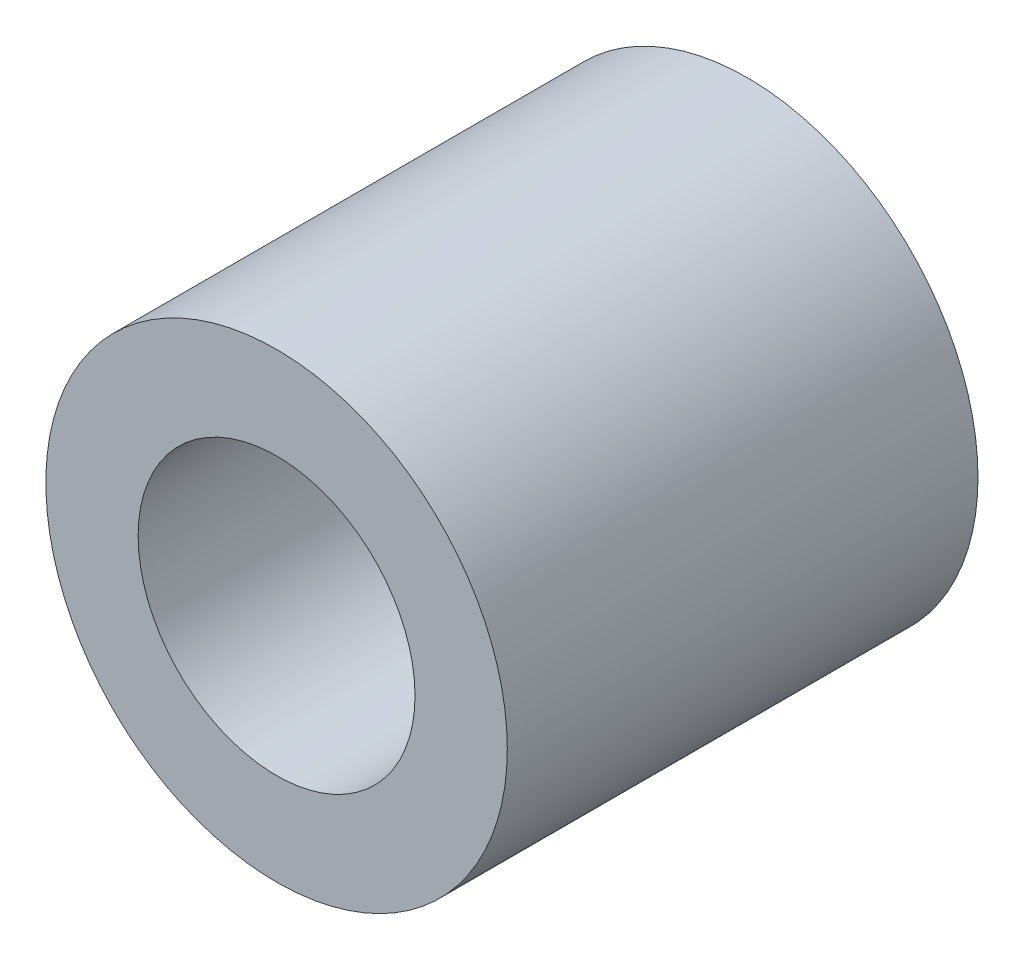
SolidWorks part; units mm, degrees
ref_plane "Front" through (0, 0, 0) normal (0, 0, 1) x (1, 0, 0)
ref_plane "Top" through (0, 0, 0) normal (0, 1, 0) x (1, 0, 0)
ref_plane "Right" through (0, 0, 0) normal (1, 0, 0) x (0, 0, -1)
sketch "Sketch1" plane through (0, 0, 0) normal (0, 0, 1) x (1, 0, 0)
  line L1 (0, 0) -> (4.8093, 0) construction
  line L3 (-4.9024, -1.5) -> (5.4609, -1.5) construction
  circle A0 centre (0, 0) radius 2.5
  circle A1 centre (0, 0) radius 1.5
  dimension "D3" = 3
  dimension "D1" = 5
extrude "Base-Extrude" add sketch "Sketch1" along normal blind 5.1
